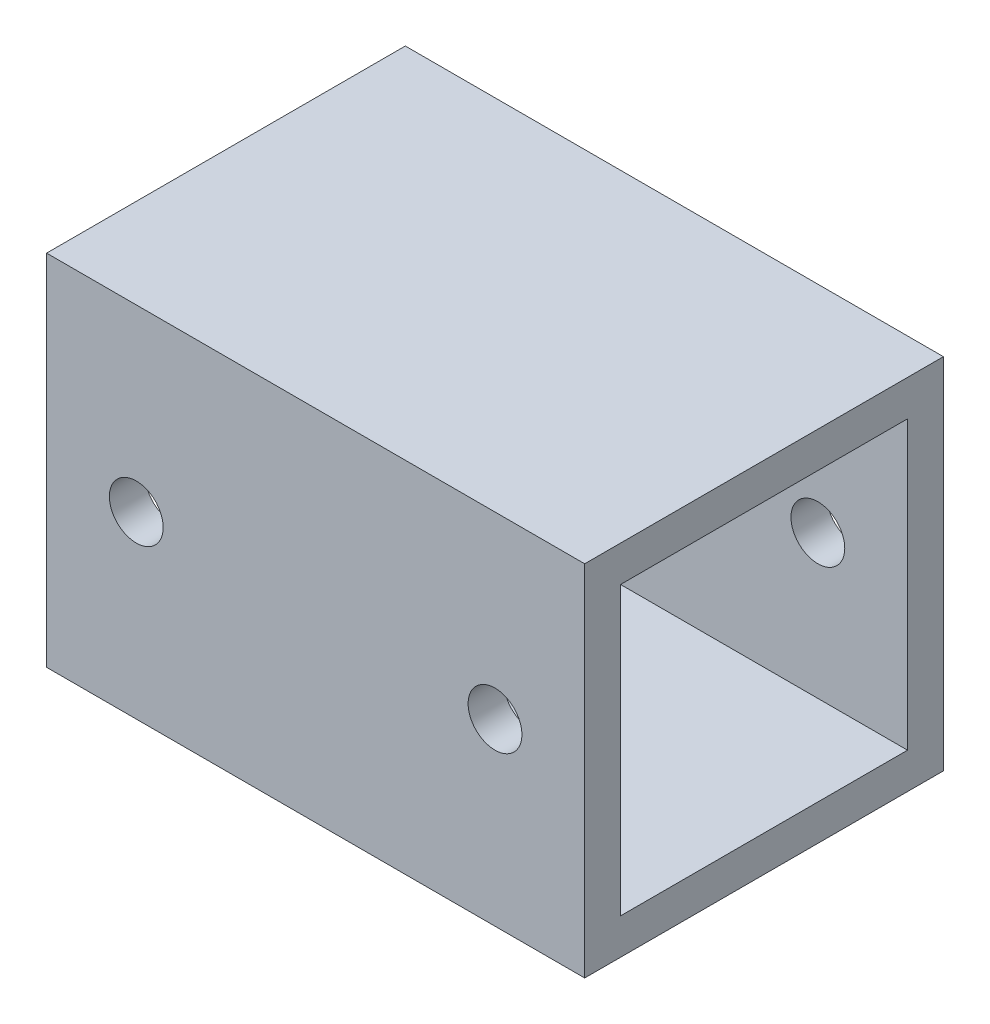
SolidWorks part; units mm, degrees
ref_plane "正面" through (0, 0, 0) normal (0, 0, 1) x (1, 0, 0)
ref_plane "平面" through (0, 0, 0) normal (0, 1, 0) x (1, 0, 0)
ref_plane "右側面" through (0, 0, 0) normal (1, 0, 0) x (0, 0, -1)
sketch "ｽｹｯﾁ1" plane through (0, 0, 0) normal (1, 0, 0) x (0, 0, -1)
  line L1 (-8, -8) -> (8, -8)
  line L2 (-8, -8) -> (-8, 8)
  line L3 (-8, 8) -> (8, 8)
  line L4 (8, -8) -> (8, 8)
  line L5 (-8, -8) -> (8, 8) construction
  line L6 (-8, 8) -> (8, -8) construction
  line L7 (-10, -10) -> (10, -10)
  line L8 (-10, -10) -> (-10, 10)
  line L9 (-10, 10) -> (10, 10)
  line L10 (10, -10) -> (10, 10)
  line L11 (-10, -10) -> (10, 10) construction
  line L12 (-10, 10) -> (10, -10) construction
  point P0 (0, 0)
  point P6 (0, 0)
  dimension "D1" = 16
  dimension "D2" = 16
  dimension "D3" = 20
extrude "押し出し1" add sketch "ｽｹｯﾁ1" along normal blind 30
sketch "ｽｹｯﾁ2" plane through (0, 0, 10) normal (0, 0, 1) x (1, 0, 0)
  line L0 (0, 0) -> (5, 0) construction
  line L1 (0, 10) -> (0, -10) construction
  circle A0 centre (5, 0) radius 1.5
  dimension "D2" = 3
  dimension "D1" = 5
extrude "押し出し2" cut sketch "ｽｹｯﾁ2" against normal through all
sketch "ｽｹｯﾁ3" plane through (0, 0, 10) normal (0, 0, 1) x (1, 0, 0)
  line L0 (0, 0) -> (25, 0) construction
  line L1 (0, 10) -> (0, -10) construction
  circle A0 centre (25, 0) radius 1.5
  dimension "D2" = 3
  dimension "D1" = 25
extrude "押し出し3" cut sketch "ｽｹｯﾁ3" against normal through all
